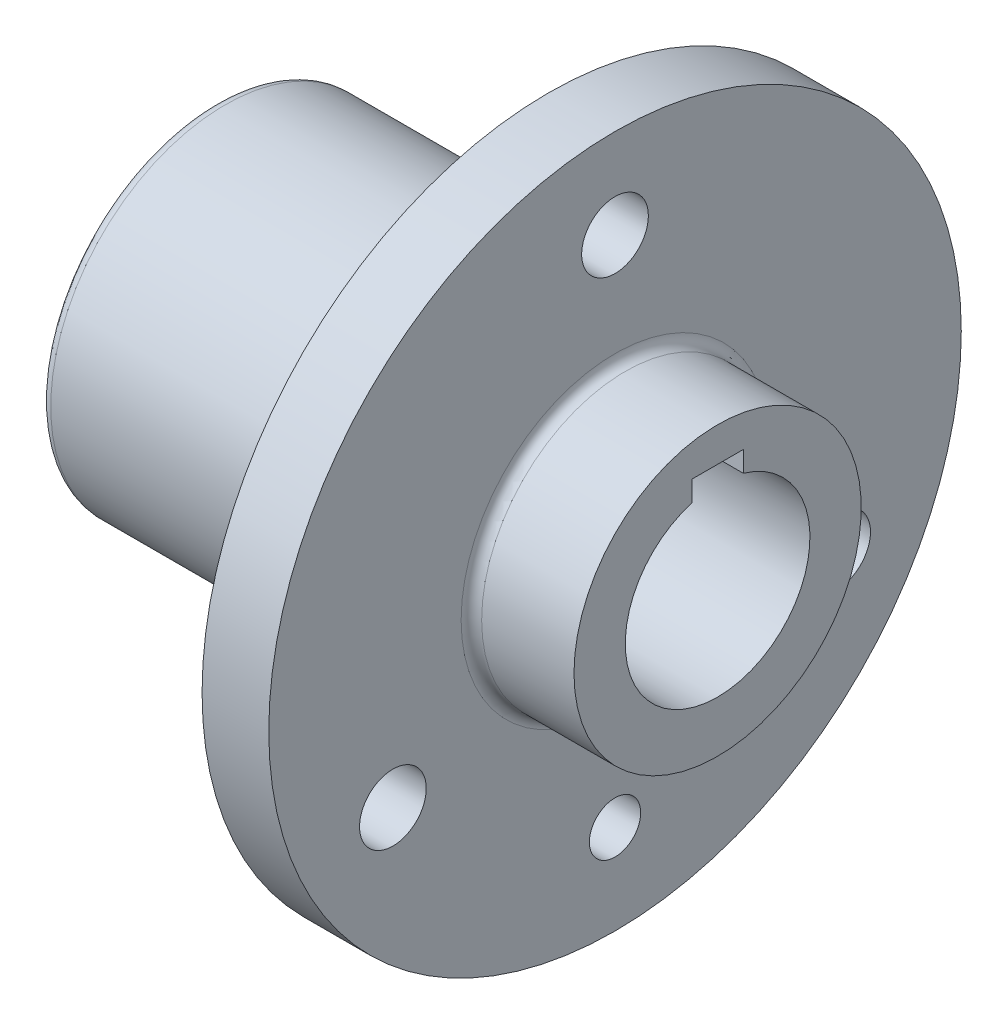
SolidWorks part; units mm, degrees
ref_plane "Front Plane" through (0, 0, 0) normal (0, 0, 1) x (1, 0, 0)
ref_plane "Top Plane" through (0, 0, 0) normal (0, 1, 0) x (1, 0, 0)
ref_plane "Right Plane" through (0, 0, 0) normal (1, 0, 0) x (0, 0, -1)
sketch "Sketch1" plane through (0, 0, 0) normal (0, 0, 1) x (1, 0, 0)
  line L0 (-48.7466, -10) -> (21.5294, -10) construction
  line L1 (-48.7466, 0) -> (-48.7466, 5)
  line L2 (-48.7466, 5) -> (-43.7466, 5)
  line L3 (-43.7466, 5) -> (-43.7466, 24)
  line L4 (-43.7466, 24) -> (21.2534, 24)
  line L5 (21.2534, 24) -> (21.2534, 57.5)
  line L6 (21.2534, 57.5) -> (34.2534, 57.5)
  line L7 (34.2534, 57.5) -> (34.2534, 18)
  line L8 (34.2534, 18) -> (54.2534, 18)
  line L9 (54.2534, 8) -> (54.2534, 18)
  line L10 (-48.7466, 0) -> (-36.7466, 0)
  line L11 (-36.7466, 0) -> (-33.7466, 3)
  line L12 (-33.7466, 3) -> (-33.7466, 14)
  line L13 (-33.7466, 14) -> (2.2534, 14)
  line L14 (2.2534, 14) -> (2.2534, 8)
  line L15 (2.2534, 8) -> (54.2534, 8)
  dimension "D1" = 10
  dimension "D2" = 15
  dimension "D3" = 34
  dimension "D4" = 24
  dimension "D5" = 12
  dimension "D6" = 36
  dimension "D7" = 52
  dimension "D8" = 98
  dimension "D9" = 20
  dimension "D10" = 13
  dimension "D11" = 67.5
  dimension "D12" = 28
  dimension "D13" = 5
  dimension "D14" = 225
  dimension "D15" = 18
revolve "Revolve1" add sketch "Sketch1" angle 360 about L0
fillet "Fillet1" radius 2 4 edges at (34.2534, -10, 28) (21.2534, -10, 34) (-43.7466, -10, 15) (-43.7466, -10, 34)
fillet "Fillet2" radius 2 2 edges at (2.2534, -10, 18) (-33.7466, -10, 24)
sketch "Sketch2" plane through (54.2534, 0, 0) normal (1, 0, 0) x (0, 0, -1)
  line L0 (0, -28) -> (12.1375, -28.5458) construction
  line L1 (-5, 4.7) -> (5, 4.7)
  line L2 (-5, 4.7) -> (-5, 11.3)
  line L3 (-5, 11.3) -> (5, 11.3)
  line L4 (5, 4.7) -> (5, 11.3)
  line L5 (-5, 4.7) -> (5, 11.3) construction
  line L6 (-5, 11.3) -> (5, 4.7) construction
  line L7 (0, 8) -> (0, -10) construction
  line L8 (0, -10) -> (0, -28) construction
  circle A0 centre (0, -10) radius 18 construction
  point P0 (0, 8)
  dimension "D1" = 10
  dimension "D2" = 39.3
extrude "Cut-Extrude1" cut sketch "Sketch2" against normal blind 52
sketch "Sketch3" plane through (34.2534, 0, 0) normal (1, 0, 0) x (0, 0, -1)
  line L0 (0, -10) -> (0, 20) construction
  line L1 (0, 20) -> (0, -10) construction
  line L2 (0, -10) -> (0, -43.4367) construction
  line L3 (0, 20) -> (0, 57.5) construction
  line L4 (0, -43.4367) -> (0, -77.5) construction
  circle A0 centre (0, -10) radius 30 construction
  circle A1 centre (0, -10) radius 67.5 construction
  circle A2 centre (0, 40) radius 6.5
  circle A3 centre (43.3013, -35) radius 6.5
  circle A4 centre (-43.3013, -35) radius 6.5
  circle A5 centre (0, -60) radius 5
  point P22 (0, -10)
  dimension "D1" = 13
  dimension "D4" = 10
  dimension "D2" = 50
  dimension "D5" = 50
  dimension "D3" = 3
extrude "Cut-Extrude2" cut sketch "Sketch3" against normal blind 52
